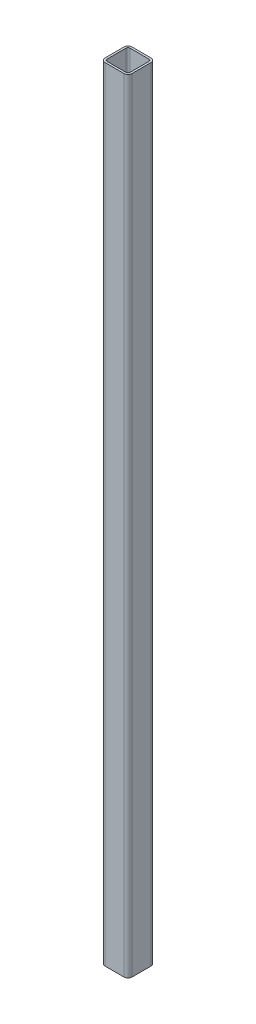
SolidWorks part; units mm, degrees
ref_plane "Plan de face" through (0, 0, 0) normal (0, 0, 1) x (1, 0, 0)
ref_plane "Plan de dessus" through (0, 0, 0) normal (0, 1, 0) x (1, 0, 0)
ref_plane "Plan de droite" through (0, 0, 0) normal (1, 0, 0) x (0, 0, -1)
sketch "Esquisse1" plane through (0, 0, 0) normal (0, 1, 0) x (1, 0, 0)
  line L1 (-7, -10) -> (7, -10)
  line L2 (-10, -7) -> (-10, 7)
  line L3 (-7, 10) -> (7, 10)
  line L4 (10, -7) -> (10, 7)
  arc A0 (-7, 10) -> (-10, 7) centre (-7, 7) ccw
  arc A1 (10, 7) -> (7, 10) centre (7, 7) ccw
  arc A2 (10, -7) -> (7, -10) centre (7, -7) cw
  arc A3 (-7, -10) -> (-10, -7) centre (-7, -7) cw
  point P4 (-10, 0)
  point P5 (0, 10)
  point P9 (-10, 10)
  point P12 (10, 10)
  point P17 (-10, -10)
  dimension "D3" = 3
  dimension "D1" = 20
  dimension "D2" = 20
extrude "Extru.-Mince1" add sketch "Esquisse1" along normal mid plane 579 thin
